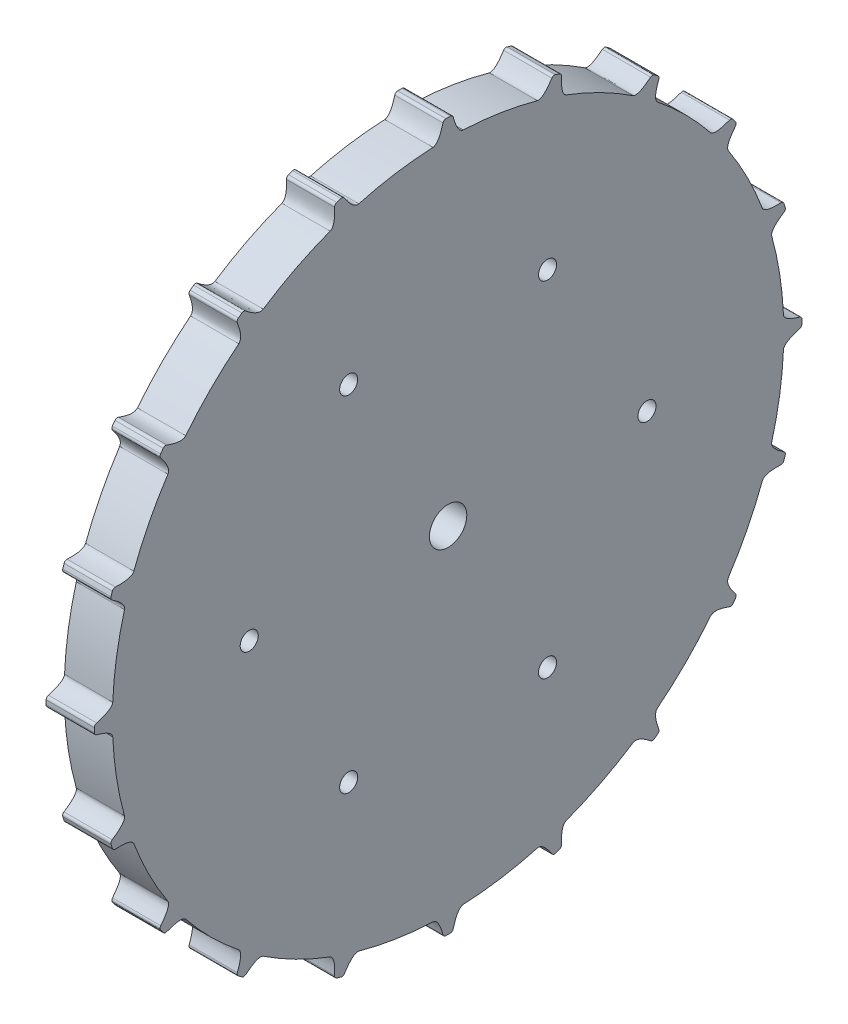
SolidWorks part; units mm, degrees
ref_plane "Plan de face" through (0, 0, 0) normal (0, 0, 1) x (1, 0, 0)
ref_plane "Plan de dessus" through (0, 0, 0) normal (0, 1, 0) x (1, 0, 0)
ref_plane "Plan de droite" through (0, 0, 0) normal (1, 0, 0) x (0, 0, -1)
sketch "Esquisse1" plane through (0, 0, 0) normal (1, 0, 0) x (0, 0, -1)
  line L0 (68.4454, 0) -> (-8.7639, 0) construction
  line L1 (0, -16.7788) -> (0, 145.6709) construction
  line L2 (2.6, 57.2898) -> (2.6, 52.4074) construction
  line L3 (0.75, 61.2404) -> (0.75, 57.5756) construction
  circle A0 centre (0, 0) radius 33 construction
  arc A1 (-2.507, 55.6486) -> (-14.8121, 53.6996) centre (0, 0) ccw
  arc A2 (0.3654, 58.7039) -> (-0.3654, 58.7039) centre (0, 0) ccw
  arc A3 (0.8448, 58.3349) -> (0.3654, 58.7039) centre (0.3623, 58.2039) ccw
  arc A4 (-0.8448, 58.3349) -> (-0.3654, 58.7039) centre (-0.3623, 58.2039) cw
  circle A5 centre (33, 0) radius 1.5
  arc A6 (17.223, 55.7408) -> (17.793, 55.9436) centre (17.6414, 55.4671) cw
  circle A7 centre (16.5, -28.5788) radius 1.5
  arc A8 (18.488, 55.7178) -> (17.793, 55.9436) centre (0, 0) ccw
  circle A9 centre (0, 0) radius 3.1
  circle A10 centre (-16.5, -28.5788) radius 1.5
  arc A11 (18.8299, 55.2187) -> (18.488, 55.7178) centre (18.3305, 55.2432) ccw
  circle A12 centre (-33, 0) radius 1.5
  arc A13 (33.6049, 47.6905) -> (34.2097, 47.7072) centre (33.9183, 47.3009) cw
  circle A14 centre (-16.5, 28.5788) radius 1.5
  arc A15 (34.8009, 47.2777) -> (34.2097, 47.7072) centre (0, 0) ccw
  circle A16 centre (16.5, 28.5788) radius 1.5
  arc A17 (34.9718, 46.6973) -> (34.8009, 47.2777) centre (34.5045, 46.875) ccw
  arc A18 (46.6973, 34.9718) -> (47.2777, 34.8009) centre (46.875, 34.5045) cw
  arc A19 (47.7072, 34.2097) -> (47.2777, 34.8009) centre (0, 0) ccw
  arc A20 (47.6905, 33.6049) -> (47.7072, 34.2097) centre (47.3009, 33.9183) ccw
  arc A21 (55.2187, 18.8299) -> (55.7178, 18.488) centre (55.2432, 18.3305) cw
  arc A22 (55.9436, 17.793) -> (55.7178, 18.488) centre (0, 0) ccw
  arc A23 (55.7408, 17.223) -> (55.9436, 17.793) centre (55.4671, 17.6414) ccw
  arc A24 (58.3349, 0.8448) -> (58.7039, 0.3654) centre (58.2039, 0.3623) cw
  arc A25 (58.7039, -0.3654) -> (58.7039, 0.3654) centre (0, 0) ccw
  circle A26 centre (-28.5788, 16.5) radius 10
  arc A27 (58.3349, -0.8448) -> (58.7039, -0.3654) centre (58.2039, -0.3623) ccw
  circle A28 centre (0, 33) radius 10
  arc A29 (55.7408, -17.223) -> (55.9436, -17.793) centre (55.4671, -17.6414) cw
  circle A30 centre (28.5788, 16.5) radius 10
  arc A31 (55.7178, -18.488) -> (55.9436, -17.793) centre (0, 0) ccw
  circle A32 centre (28.5788, -16.5) radius 10
  circle A33 centre (0, -33) radius 10
  circle A34 centre (-28.5788, -16.5) radius 10
  arc A35 (55.2187, -18.8299) -> (55.7178, -18.488) centre (55.2432, -18.3305) ccw
  arc A36 (47.6905, -33.6049) -> (47.7072, -34.2097) centre (47.3009, -33.9183) cw
  arc A37 (47.2777, -34.8009) -> (47.7072, -34.2097) centre (0, 0) ccw
  arc A38 (46.6973, -34.9718) -> (47.2777, -34.8009) centre (46.875, -34.5045) ccw
  arc A39 (34.9718, -46.6973) -> (34.8009, -47.2777) centre (34.5045, -46.875) cw
  arc A40 (34.2097, -47.7072) -> (34.8009, -47.2777) centre (0, 0) ccw
  arc A41 (33.6049, -47.6905) -> (34.2097, -47.7072) centre (33.9183, -47.3009) ccw
  arc A42 (18.8299, -55.2187) -> (18.488, -55.7178) centre (18.3305, -55.2432) cw
  arc A43 (17.793, -55.9436) -> (18.488, -55.7178) centre (0, 0) ccw
  arc A44 (17.223, -55.7408) -> (17.793, -55.9436) centre (17.6414, -55.4671) ccw
  arc A45 (0.8448, -58.3349) -> (0.3654, -58.7039) centre (0.3623, -58.2039) cw
  arc A46 (-0.3654, -58.7039) -> (0.3654, -58.7039) centre (0, 0) ccw
  arc A47 (-0.8448, -58.3349) -> (-0.3654, -58.7039) centre (-0.3623, -58.2039) ccw
  arc A48 (-17.223, -55.7408) -> (-17.793, -55.9436) centre (-17.6414, -55.4671) cw
  arc A49 (-18.488, -55.7178) -> (-17.793, -55.9436) centre (0, 0) ccw
  arc A50 (-18.8299, -55.2187) -> (-18.488, -55.7178) centre (-18.3305, -55.2432) ccw
  arc A51 (-33.6049, -47.6905) -> (-34.2097, -47.7072) centre (-33.9183, -47.3009) cw
  arc A52 (-34.8009, -47.2777) -> (-34.2097, -47.7072) centre (0, 0) ccw
  arc A53 (-34.9718, -46.6973) -> (-34.8009, -47.2777) centre (-34.5045, -46.875) ccw
  arc A54 (-46.6973, -34.9718) -> (-47.2777, -34.8009) centre (-46.875, -34.5045) cw
  arc A55 (-47.7072, -34.2097) -> (-47.2777, -34.8009) centre (0, 0) ccw
  arc A56 (-47.6905, -33.6049) -> (-47.7072, -34.2097) centre (-47.3009, -33.9183) ccw
  arc A57 (-55.2187, -18.8299) -> (-55.7178, -18.488) centre (-55.2432, -18.3305) cw
  arc A58 (-55.9436, -17.793) -> (-55.7178, -18.488) centre (0, 0) ccw
  arc A59 (-55.7408, -17.223) -> (-55.9436, -17.793) centre (-55.4671, -17.6414) ccw
  arc A60 (-58.3349, -0.8448) -> (-58.7039, -0.3654) centre (-58.2039, -0.3623) cw
  arc A61 (-58.7039, 0.3654) -> (-58.7039, -0.3654) centre (0, 0) ccw
  arc A62 (-58.3349, 0.8448) -> (-58.7039, 0.3654) centre (-58.2039, 0.3623) ccw
  arc A63 (-55.7408, 17.223) -> (-55.9436, 17.793) centre (-55.4671, 17.6414) cw
  arc A64 (-55.7178, 18.488) -> (-55.9436, 17.793) centre (0, 0) ccw
  arc A65 (-55.2187, 18.8299) -> (-55.7178, 18.488) centre (-55.2432, 18.3305) ccw
  arc A66 (-47.6905, 33.6049) -> (-47.7072, 34.2097) centre (-47.3009, 33.9183) cw
  arc A67 (-47.2777, 34.8009) -> (-47.7072, 34.2097) centre (0, 0) ccw
  arc A68 (-46.6973, 34.9718) -> (-47.2777, 34.8009) centre (-46.875, 34.5045) ccw
  arc A69 (-34.9718, 46.6973) -> (-34.8009, 47.2777) centre (-34.5045, 46.875) cw
  arc A70 (-34.2097, 47.7072) -> (-34.8009, 47.2777) centre (0, 0) ccw
  arc A71 (-33.6049, 47.6905) -> (-34.2097, 47.7072) centre (-33.9183, 47.3009) ccw
  arc A72 (-18.8299, 55.2187) -> (-18.488, 55.7178) centre (-18.3305, 55.2432) cw
  arc A73 (-17.793, 55.9436) -> (-18.488, 55.7178) centre (0, 0) ccw
  arc A74 (-17.223, 55.7408) -> (-17.793, 55.9436) centre (-17.6414, 55.4671) ccw
  arc A75 (14.8121, 53.6996) -> (2.507, 55.6486) centre (0, 0) ccw
  arc A76 (30.6812, 46.4942) -> (19.5806, 52.1502) centre (0, 0) ccw
  arc A77 (43.5471, 34.7376) -> (34.7376, 43.5471) centre (0, 0) ccw
  arc A78 (52.1502, 19.5806) -> (46.4942, 30.6812) centre (0, 0) ccw
  arc A79 (55.6486, 2.507) -> (53.6996, 14.8121) centre (0, 0) ccw
  arc A80 (53.6996, -14.8121) -> (55.6486, -2.507) centre (0, 0) ccw
  arc A81 (46.4942, -30.6812) -> (52.1502, -19.5806) centre (0, 0) ccw
  arc A82 (34.7376, -43.5471) -> (43.5471, -34.7376) centre (0, 0) ccw
  arc A83 (19.5806, -52.1502) -> (30.6812, -46.4942) centre (0, 0) ccw
  arc A84 (2.507, -55.6486) -> (14.8121, -53.6996) centre (0, 0) ccw
  arc A85 (-14.8121, -53.6996) -> (-2.507, -55.6486) centre (0, 0) ccw
  arc A86 (-30.6812, -46.4942) -> (-19.5806, -52.1502) centre (0, 0) ccw
  arc A87 (-43.5471, -34.7376) -> (-34.7376, -43.5471) centre (0, 0) ccw
  arc A88 (-52.1502, -19.5806) -> (-46.4942, -30.6812) centre (0, 0) ccw
  arc A89 (-55.6486, -2.507) -> (-53.6996, -14.8121) centre (0, 0) ccw
  arc A90 (-53.6996, 14.8121) -> (-55.6486, 2.507) centre (0, 0) ccw
  arc A91 (-46.4942, 30.6812) -> (-52.1502, 19.5806) centre (0, 0) ccw
  arc A92 (-34.7376, 43.5471) -> (-43.5471, 34.7376) centre (0, 0) ccw
  arc A93 (-19.5806, 52.1502) -> (-30.6812, 46.4942) centre (0, 0) ccw
  spline S0 degree 3 poles (0.8448, 58.3349) (1.0785, 57.4741) (1.5892, 56.1656) (2.1866, 55.6832) (2.507, 55.6486) knots 0.061336 0.061336 0.061336 0.061336 0.50914 0.956945 0.956945 0.956945 0.956945
  spline S1 degree 3 poles (-0.8448, 58.3349) (-1.0785, 57.4741) (-1.5892, 56.1656) (-2.1866, 55.6832) (-2.507, 55.6486) knots 0.061336 0.061336 0.061336 0.061336 0.50914 0.956945 0.956945 0.956945 0.956945
  spline S2 degree 3 poles (17.223, 55.7408) (16.7347, 54.9944) (15.8447, 53.9078) (15.1274, 53.6336) (14.8121, 53.6996) knots 0.061336 0.061336 0.061336 0.061336 0.50914 0.956945 0.956945 0.956945 0.956945
  spline S3 degree 3 poles (18.8299, 55.2187) (18.7862, 54.3278) (18.8676, 52.9255) (19.2867, 52.2822) (19.5806, 52.1502) knots 0.061336 0.061336 0.061336 0.061336 0.50914 0.956945 0.956945 0.956945 0.956945
  spline S4 degree 3 poles (33.6049, 47.6905) (32.9099, 47.1315) (31.7276, 46.373) (30.9607, 46.3339) (30.6812, 46.4942) knots 0.061336 0.061336 0.061336 0.061336 0.50914 0.956945 0.956945 0.956945 0.956945
  spline S5 degree 3 poles (34.9718, 46.6973) (34.655, 45.8636) (34.299, 44.5048) (34.4988, 43.7634) (34.7376, 43.5471) knots 0.061336 0.061336 0.061336 0.061336 0.50914 0.956945 0.956945 0.956945 0.956945
  spline S6 degree 3 poles (46.6973, 34.9718) (45.8636, 34.655) (44.5048, 34.299) (43.7634, 34.4988) (43.5471, 34.7376) knots 0.061336 0.061336 0.061336 0.061336 0.50914 0.956945 0.956945 0.956945 0.956945
  spline S7 degree 3 poles (47.6905, 33.6049) (47.1315, 32.9099) (46.373, 31.7276) (46.3339, 30.9607) (46.4942, 30.6812) knots 0.061336 0.061336 0.061336 0.061336 0.50914 0.956945 0.956945 0.956945 0.956945
  spline S8 degree 3 poles (55.2187, 18.8299) (54.3278, 18.7862) (52.9255, 18.8676) (52.2822, 19.2867) (52.1502, 19.5806) knots 0.061336 0.061336 0.061336 0.061336 0.50914 0.956945 0.956945 0.956945 0.956945
  spline S9 degree 3 poles (55.7408, 17.223) (54.9944, 16.7347) (53.9078, 15.8447) (53.6336, 15.1274) (53.6996, 14.8121) knots 0.061336 0.061336 0.061336 0.061336 0.50914 0.956945 0.956945 0.956945 0.956945
  spline S10 degree 3 poles (58.3349, 0.8448) (57.4741, 1.0785) (56.1656, 1.5892) (55.6832, 2.1866) (55.6486, 2.507) knots 0.061336 0.061336 0.061336 0.061336 0.50914 0.956945 0.956945 0.956945 0.956945
  spline S11 degree 3 poles (58.3349, -0.8448) (57.4741, -1.0785) (56.1656, -1.5892) (55.6832, -2.1866) (55.6486, -2.507) knots 0.061336 0.061336 0.061336 0.061336 0.50914 0.956945 0.956945 0.956945 0.956945
  spline S12 degree 3 poles (55.7408, -17.223) (54.9944, -16.7347) (53.9078, -15.8447) (53.6336, -15.1274) (53.6996, -14.8121) knots 0.061336 0.061336 0.061336 0.061336 0.50914 0.956945 0.956945 0.956945 0.956945
  spline S13 degree 3 poles (55.2187, -18.8299) (54.3278, -18.7862) (52.9255, -18.8676) (52.2822, -19.2867) (52.1502, -19.5806) knots 0.061336 0.061336 0.061336 0.061336 0.50914 0.956945 0.956945 0.956945 0.956945
  spline S14 degree 3 poles (47.6905, -33.6049) (47.1315, -32.9099) (46.373, -31.7276) (46.3339, -30.9607) (46.4942, -30.6812) knots 0.061336 0.061336 0.061336 0.061336 0.50914 0.956945 0.956945 0.956945 0.956945
  spline S15 degree 3 poles (46.6973, -34.9718) (45.8636, -34.655) (44.5048, -34.299) (43.7634, -34.4988) (43.5471, -34.7376) knots 0.061336 0.061336 0.061336 0.061336 0.50914 0.956945 0.956945 0.956945 0.956945
  spline S16 degree 3 poles (34.9718, -46.6973) (34.655, -45.8636) (34.299, -44.5048) (34.4988, -43.7634) (34.7376, -43.5471) knots 0.061336 0.061336 0.061336 0.061336 0.50914 0.956945 0.956945 0.956945 0.956945
  spline S17 degree 3 poles (33.6049, -47.6905) (32.9099, -47.1315) (31.7276, -46.373) (30.9607, -46.3339) (30.6812, -46.4942) knots 0.061336 0.061336 0.061336 0.061336 0.50914 0.956945 0.956945 0.956945 0.956945
  spline S18 degree 3 poles (18.8299, -55.2187) (18.7862, -54.3278) (18.8676, -52.9255) (19.2867, -52.2822) (19.5806, -52.1502) knots 0.061336 0.061336 0.061336 0.061336 0.50914 0.956945 0.956945 0.956945 0.956945
  spline S19 degree 3 poles (17.223, -55.7408) (16.7347, -54.9944) (15.8447, -53.9078) (15.1274, -53.6336) (14.8121, -53.6996) knots 0.061336 0.061336 0.061336 0.061336 0.50914 0.956945 0.956945 0.956945 0.956945
  spline S20 degree 3 poles (0.8448, -58.3349) (1.0785, -57.4741) (1.5892, -56.1656) (2.1866, -55.6832) (2.507, -55.6486) knots 0.061336 0.061336 0.061336 0.061336 0.50914 0.956945 0.956945 0.956945 0.956945
  spline S21 degree 3 poles (-0.8448, -58.3349) (-1.0785, -57.4741) (-1.5892, -56.1656) (-2.1866, -55.6832) (-2.507, -55.6486) knots 0.061336 0.061336 0.061336 0.061336 0.50914 0.956945 0.956945 0.956945 0.956945
  spline S22 degree 3 poles (-17.223, -55.7408) (-16.7347, -54.9944) (-15.8447, -53.9078) (-15.1274, -53.6336) (-14.8121, -53.6996) knots 0.061336 0.061336 0.061336 0.061336 0.50914 0.956945 0.956945 0.956945 0.956945
  spline S23 degree 3 poles (-18.8299, -55.2187) (-18.7862, -54.3278) (-18.8676, -52.9255) (-19.2867, -52.2822) (-19.5806, -52.1502) knots 0.061336 0.061336 0.061336 0.061336 0.50914 0.956945 0.956945 0.956945 0.956945
  spline S24 degree 3 poles (-33.6049, -47.6905) (-32.9099, -47.1315) (-31.7276, -46.373) (-30.9607, -46.3339) (-30.6812, -46.4942) knots 0.061336 0.061336 0.061336 0.061336 0.50914 0.956945 0.956945 0.956945 0.956945
  spline S25 degree 3 poles (-34.9718, -46.6973) (-34.655, -45.8636) (-34.299, -44.5048) (-34.4988, -43.7634) (-34.7376, -43.5471) knots 0.061336 0.061336 0.061336 0.061336 0.50914 0.956945 0.956945 0.956945 0.956945
  spline S26 degree 3 poles (-46.6973, -34.9718) (-45.8636, -34.655) (-44.5048, -34.299) (-43.7634, -34.4988) (-43.5471, -34.7376) knots 0.061336 0.061336 0.061336 0.061336 0.50914 0.956945 0.956945 0.956945 0.956945
  spline S27 degree 3 poles (-47.6905, -33.6049) (-47.1315, -32.9099) (-46.373, -31.7276) (-46.3339, -30.9607) (-46.4942, -30.6812) knots 0.061336 0.061336 0.061336 0.061336 0.50914 0.956945 0.956945 0.956945 0.956945
  spline S28 degree 3 poles (-55.2187, -18.8299) (-54.3278, -18.7862) (-52.9255, -18.8676) (-52.2822, -19.2867) (-52.1502, -19.5806) knots 0.061336 0.061336 0.061336 0.061336 0.50914 0.956945 0.956945 0.956945 0.956945
  spline S29 degree 3 poles (-55.7408, -17.223) (-54.9944, -16.7347) (-53.9078, -15.8447) (-53.6336, -15.1274) (-53.6996, -14.8121) knots 0.061336 0.061336 0.061336 0.061336 0.50914 0.956945 0.956945 0.956945 0.956945
  spline S30 degree 3 poles (-58.3349, -0.8448) (-57.4741, -1.0785) (-56.1656, -1.5892) (-55.6832, -2.1866) (-55.6486, -2.507) knots 0.061336 0.061336 0.061336 0.061336 0.50914 0.956945 0.956945 0.956945 0.956945
  spline S31 degree 3 poles (-58.3349, 0.8448) (-57.4741, 1.0785) (-56.1656, 1.5892) (-55.6832, 2.1866) (-55.6486, 2.507) knots 0.061336 0.061336 0.061336 0.061336 0.50914 0.956945 0.956945 0.956945 0.956945
  spline S32 degree 3 poles (-55.7408, 17.223) (-54.9944, 16.7347) (-53.9078, 15.8447) (-53.6336, 15.1274) (-53.6996, 14.8121) knots 0.061336 0.061336 0.061336 0.061336 0.50914 0.956945 0.956945 0.956945 0.956945
  spline S33 degree 3 poles (-55.2187, 18.8299) (-54.3278, 18.7862) (-52.9255, 18.8676) (-52.2822, 19.2867) (-52.1502, 19.5806) knots 0.061336 0.061336 0.061336 0.061336 0.50914 0.956945 0.956945 0.956945 0.956945
  spline S34 degree 3 poles (-47.6905, 33.6049) (-47.1315, 32.9099) (-46.373, 31.7276) (-46.3339, 30.9607) (-46.4942, 30.6812) knots 0.061336 0.061336 0.061336 0.061336 0.50914 0.956945 0.956945 0.956945 0.956945
  spline S35 degree 3 poles (-46.6973, 34.9718) (-45.8636, 34.655) (-44.5048, 34.299) (-43.7634, 34.4988) (-43.5471, 34.7376) knots 0.061336 0.061336 0.061336 0.061336 0.50914 0.956945 0.956945 0.956945 0.956945
  spline S36 degree 3 poles (-34.9718, 46.6973) (-34.655, 45.8636) (-34.299, 44.5048) (-34.4988, 43.7634) (-34.7376, 43.5471) knots 0.061336 0.061336 0.061336 0.061336 0.50914 0.956945 0.956945 0.956945 0.956945
  spline S37 degree 3 poles (-33.6049, 47.6905) (-32.9099, 47.1315) (-31.7276, 46.373) (-30.9607, 46.3339) (-30.6812, 46.4942) knots 0.061336 0.061336 0.061336 0.061336 0.50914 0.956945 0.956945 0.956945 0.956945
  spline S38 degree 3 poles (-18.8299, 55.2187) (-18.7862, 54.3278) (-18.8676, 52.9255) (-19.2867, 52.2822) (-19.5806, 52.1502) knots 0.061336 0.061336 0.061336 0.061336 0.50914 0.956945 0.956945 0.956945 0.956945
  spline S39 degree 3 poles (-17.223, 55.7408) (-16.7347, 54.9944) (-15.8447, 53.9078) (-15.1274, 53.6336) (-14.8121, 53.6996) knots 0.061336 0.061336 0.061336 0.061336 0.50914 0.956945 0.956945 0.956945 0.956945
  dimension "D2" = 6
  dimension "D1" = 2.6
  dimension "D4" = 0.5
  dimension "D3" = 0.75
  dimension "D5" = 20
extrude "Boss.-Extru.1" add sketch "Esquisse1" along normal blind 8
